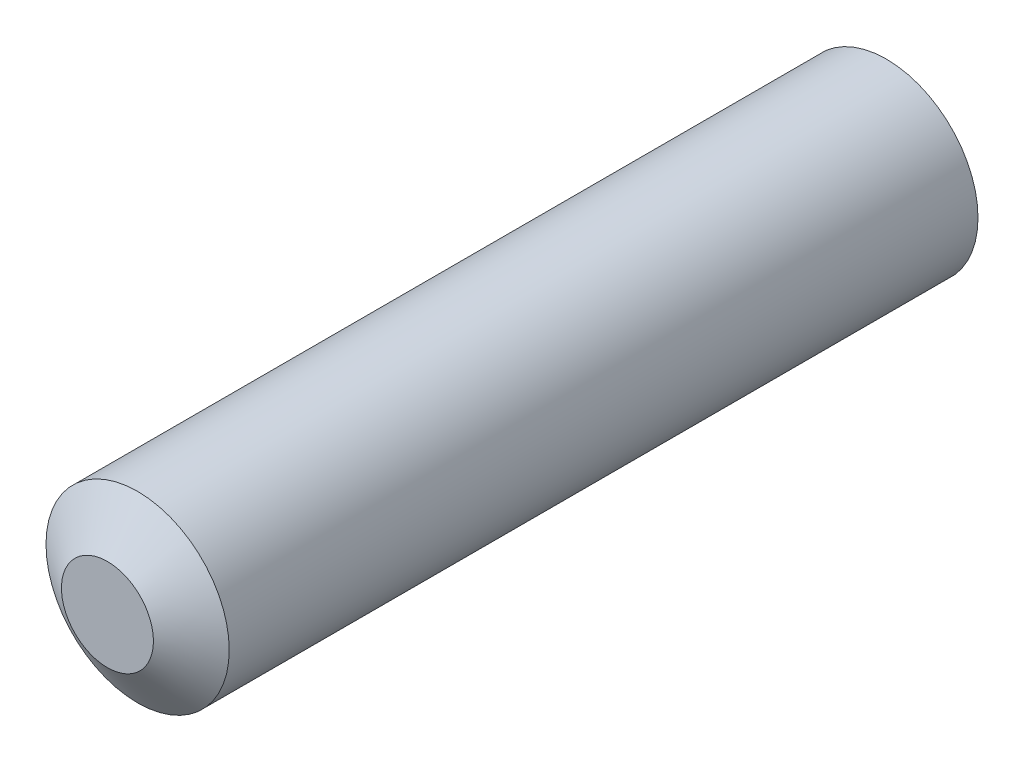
SolidWorks part; units mm, degrees
ref_plane "Front Plane" through (0, 0, 0) normal (0, 0, 1) x (1, 0, 0)
ref_plane "Top Plane" through (0, 0, 0) normal (0, 1, 0) x (1, 0, 0)
ref_plane "Right Plane" through (0, 0, 0) normal (1, 0, 0) x (0, 0, -1)
sketch "Sketch1" plane through (0, 0, 0) normal (0, 0, 1) x (1, 0, 0)
  circle A0 centre (0, 0) radius 1.275
  dimension "D1" = 2.55
extrude "Boss-Extrude1" add sketch "Sketch1" against normal blind 11.26
chamfer "Chamfer1" distance 0.42 distance2 0.635 1 edges at (1.275, 0, 0)
chamfer "Chamfer2" distance 0.635 distance2 0.42 1 edges at (1.275, 0, -11.26)
